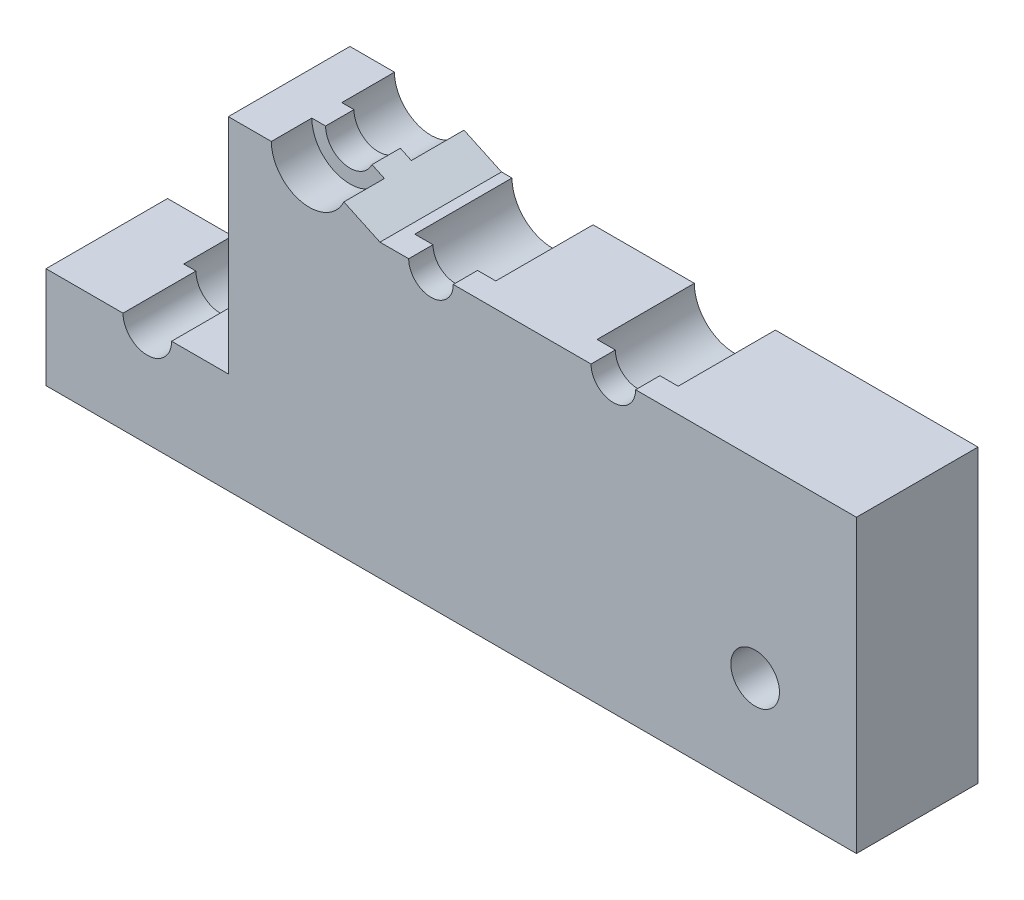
SolidWorks part; units mm, degrees
ref_plane "Plan1" through (0, 0, 0) normal (0, 0, 1) x (1, 0, 0)
ref_plane "Plan2" through (0, 0, 0) normal (0, 1, 0) x (1, 0, 0)
ref_plane "Plan3" through (0, 0, 0) normal (1, 0, 0) x (0, 0, -1)
sketch "Esquisse1" plane through (0, 0, 0) normal (0, 0, 1) x (1, 0, 0)
  line L1 (0, 0) -> (200, 0)
  line L2 (0, 0) -> (0, 150)
  line L3 (0, 150) -> (200, 150)
  line L4 (200, 0) -> (200, 150)
  dimension "D1" = 150
  dimension "D2" = 200
extrude "Base-Extrusion" add sketch "Esquisse1" along normal blind 30
sketch "Esquisse2" plane through (0, 0, 30) normal (0, 0, 1) x (1, 0, 0)
  line L0 (-10, 80) -> (90, 80) construction
  line L3 (200, 0) -> (200, 150) construction
  line L4 (200, 150) -> (0, 150) construction
  circle A5 centre (65, 80) radius 9.39
  dimension "D2" = 135
  dimension "D11" = 18.78
  dimension "D4" = 70
extrude "Enlèv. mat.-Extru.1" cut sketch "Esquisse2" against normal blind 10
sketch "Esquisse3" plane through (0, 0, 20) normal (0, 0, 1) x (1, 0, 0)
  circle A0 centre (65, 80) radius 6
  dimension "D1" = 12
extrude "Enlèv. mat.-Extru.2" cut sketch "Esquisse3" against normal blind 7
sketch "Esquisse10" plane through (0, 0, 13) normal (0, 0, 1) x (1, 0, 0)
  circle A0 centre (65, 80) radius 9
  dimension "D1" = 18
extrude "Enlèv. mat.-Extru.9" cut sketch "Esquisse10" against normal through all
sketch "Esquisse11" plane through (0, 0, 30) normal (0, 0, 1) x (1, 0, 0)
  line L0 (31.2407, 71.88) -> (187.6931, 71.88) construction
  line L1 (200, 0) -> (200, 150) construction
  circle A1 centre (95, 71.88) radius 5.5
  circle A2 centre (140, 71.88) radius 5.5
  circle A3 centre (65, 80) radius 6 construction
  dimension "D1" = 8.12
  dimension "D2" = 45
  dimension "D3" = 60
  dimension "D4" = 11
  dimension "D5" = 11
extrude "Enlèv. mat.-Extru.10" cut sketch "Esquisse11" against normal blind 6
sketch "Esquisse12" plane through (0, 0, 24) normal (0, 0, 1) x (1, 0, 0)
  circle A0 centre (140, 71.88) radius 10
  circle A1 centre (95, 71.88) radius 10
  dimension "D1" = 20
  dimension "D2" = 20
extrude "Enlèv. mat.-Extru.11" cut sketch "Esquisse12" against normal through all
sketch "Esquisse8" plane through (0, 0, 30) normal (0, 0, 1) x (1, 0, 0)
  line L1 (200, 0) -> (200, 150) construction
  line L2 (0, 0) -> (200, 0) construction
  circle A0 centre (25, 125) radius 6
  circle A1 centre (25, 25) radius 6
  circle A2 centre (175, 25) radius 6
  circle A3 centre (175, 125) radius 6
  dimension "D1" = 12
  dimension "D2" = 12
  dimension "D3" = 12
  dimension "D4" = 12
  dimension "D5" = 150
  dimension "D6" = 25
  dimension "D8" = 150
  dimension "D10" = 100
  dimension "D11" = 100
  dimension "D12" = 25
  dimension "D7" = 25
  dimension "D9" = 25
extrude "Enlèv. mat.-Extru.7" cut sketch "Esquisse8" against normal blind 18
sketch "Esquisse9" plane through (0, 0, 12) normal (0, 0, 1) x (1, 0, 0)
  circle A0 centre (25, 125) radius 9
  circle A1 centre (175, 125) radius 9
  circle A2 centre (175, 25) radius 9
  circle A3 centre (25, 25) radius 9
  dimension "D1" = 18
  dimension "D2" = 18
  dimension "D3" = 18
  dimension "D4" = 18
extrude "Enlèv. mat.-Extru.8" cut sketch "Esquisse9" against normal through all
sketch "Esquisse13" plane through (0, 0, 0) normal (0, 0, -1) x (-1, 0, 0)
  line L0 (5.3864, 25) -> (-45, 25)
  line L1 (-45, 80) -> (-65, 80)
  line L2 (-65, 80) -> (-82.4134, 71.88)
  line L3 (-82.4134, 71.88) -> (-209.8104, 71.88)
  line L4 (-45, 80) -> (-45, 25)
  line L5 (0, 150) -> (0, 0) construction
  dimension "D1" = 45
  dimension "D2" = 25
  dimension "D3" = 8.12
extrude "Enlèv. mat.-Extru.12" cut sketch "Esquisse13" against normal through all and the other way through all flip side to cut
